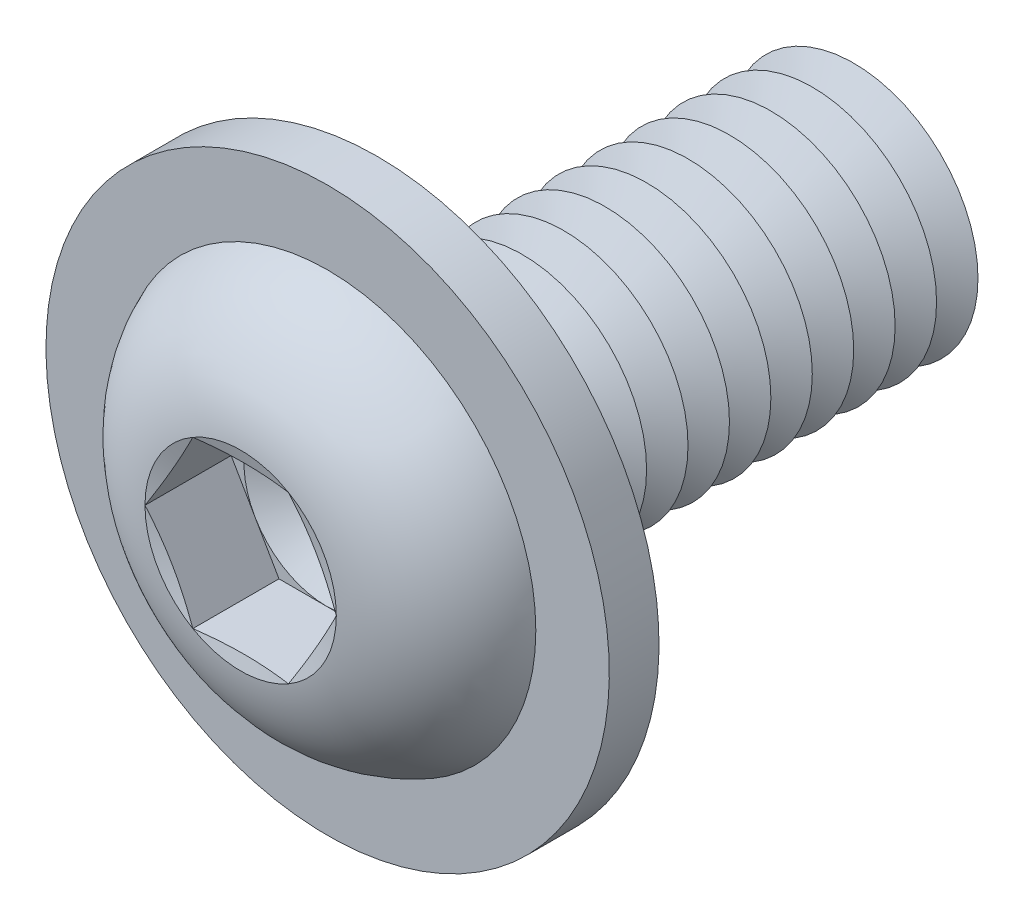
SolidWorks part; units mm, degrees
ref_plane "Front Plane" through (0, 0, 0) normal (0, 0, 1) x (1, 0, 0)
ref_plane "Top Plane" through (0, 0, 0) normal (0, 1, 0) x (1, 0, 0)
ref_plane "Right Plane" through (0, 0, 0) normal (1, 0, 0) x (0, 0, -1)
sketch "Sketch1" plane through (0, 0, 0) normal (1, 0, 0) x (0, 0, -1)
  line L0 (0, 3) -> (0, 5.25)
  line L3 (0, 3) -> (12, 3)
  line L4 (12, 3) -> (12, 0)
  line L5 (12, 0) -> (-3.3, 0) construction
  line L6 (-3.3, 0) -> (12, 0)
  line L7 (-3.3, 2.3094) -> (-3.3, 1.1547) construction
  line L8 (-3.3, 1.1547) -> (-3.3, 0)
  line L9 (-3.3, 2.3094) -> (-2.9906, 1.1547)
  line L10 (-2.9906, 1.1547) -> (-3.3, 1.1547)
  line L11 (12, 0) -> (22.7481, 0) construction
  line L12 (0, 5.25) -> (-3.3, 5.25) construction
  arc A1 (0, 5.25) -> (-3.3, 2.3094) centre (0, 1.928) ccw
  point P8 (12, 1.5)
  dimension "D1" = 10.5
  dimension "D2" = 6
  dimension "D3" = 3.3
  dimension "D4" = 4.6188
  dimension "D5" = 12
  dimension "D6" = 15
revolve "Revolve1" add sketch "Sketch1" angle 360 about L5
fillet "Fillet1" radius 0.5 1 edges at (-3, 0, 0)
sketch "Sketch2" plane through (0, 0, 0) normal (1, 0, 0) x (0, 0, -1)
  line L0 (11.5, 3) -> (12.5, 3)
  line L1 (12, 3) -> (0.5, 3) construction
  line L2 (12.5, 3) -> (12, 2.134)
  line L3 (12, -3) -> (12, 3) construction
  line L4 (12, 2.134) -> (11.5, 3)
  dimension "D1" = 1
revolve "Cut-Revolve1" cut sketch "Sketch2" angle 360 about axis through (0, 0, -12) along (0, 0, -1)
pattern_linear "LPattern1" count 12 spacing 1 along (0, 0, 1) of "Cut-Revolve1"
sketch "Sketch3" plane through (0, 0, 3.3) normal (0, 0, 1) x (1, 0, 0)
  line L7 (1.1547, 2) -> (-1.1547, 2)
  line L8 (-1.1547, 2) -> (-2.3094, 0)
  line L9 (-2.3094, 0) -> (-1.1547, -2)
  line L10 (-1.1547, -2) -> (1.1547, -2)
  line L11 (1.1547, -2) -> (2.3094, 0)
  line L12 (2.3094, 0) -> (1.1547, 2)
  circle A0 centre (0, 0) radius 2 construction
  circle A3 centre (0, 0) radius 2.3094 construction
extrude "Cut-Extrude1" cut sketch "Sketch3" against normal blind 2.08
sketch "Sketch4" plane through (0, 0, 1.22) normal (0, 0, 1) x (1, 0, 0)
  line L1 (1.1547, 2) -> (-1.1547, 2) construction
  circle A0 centre (0, 0) radius 2
extrude "Cut-Extrude2" cut sketch "Sketch4" against normal through all draft 60
sketch "Sketch5" plane through (0, 0, 0) normal (0, 0, -1) x (-1, 0, 0)
  circle A0 centre (0, 0) radius 6.8
  circle A1 centre (0, 0) radius 3.5
  circle A2 centre (0, 0) radius 3.5 construction
  dimension "D1" = 13.6
extrude "Boss-Extrude1" add sketch "Sketch5" against normal blind 1.2
